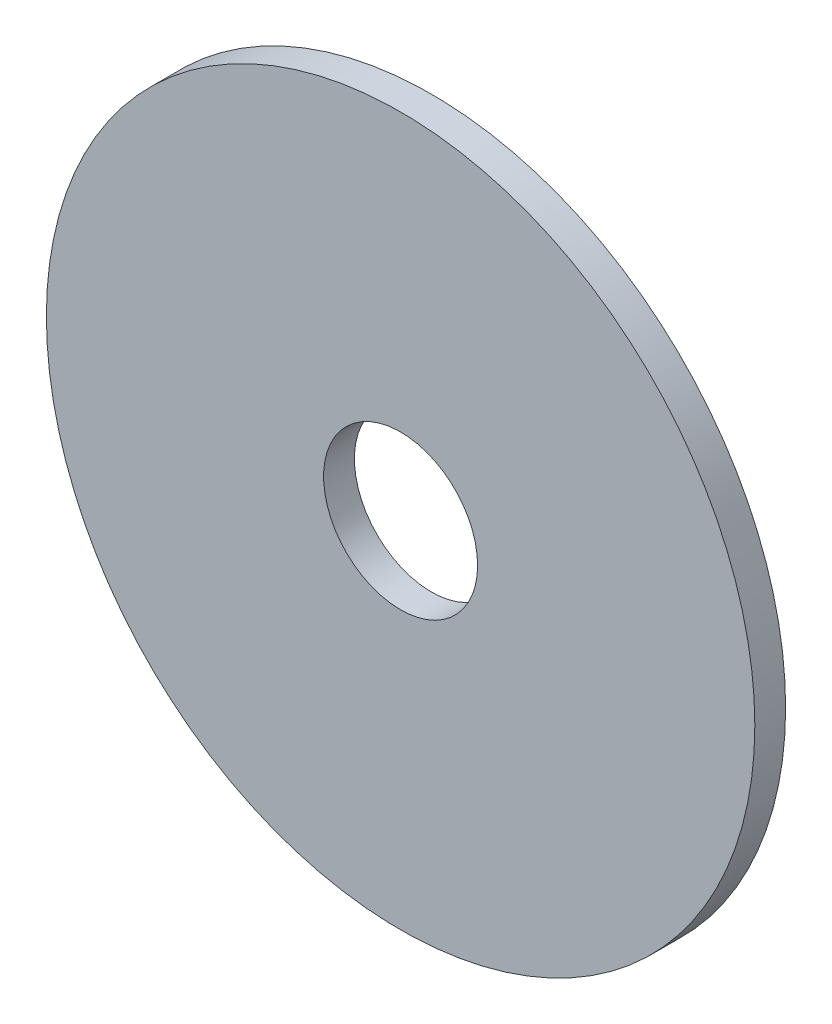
SolidWorks part; units mm, degrees
ref_plane "Plan de face" through (0, 0, 0) normal (0, 0, 1) x (1, 0, 0)
ref_plane "Plan de dessus" through (0, 0, 0) normal (0, 1, 0) x (1, 0, 0)
ref_plane "Plan de droite" through (0, 0, 0) normal (1, 0, 0) x (0, 0, -1)
sketch "Esquisse1" plane through (0, 0, 0) normal (0, 0, 1) x (1, 0, 0)
  circle A0 centre (0, 0) radius 57.5
  circle A1 centre (0, 0) radius 12.5
  dimension "D1" = 115
  dimension "D2" = 25
extrude "Extrusion1" add sketch "Esquisse1" along normal blind 5
